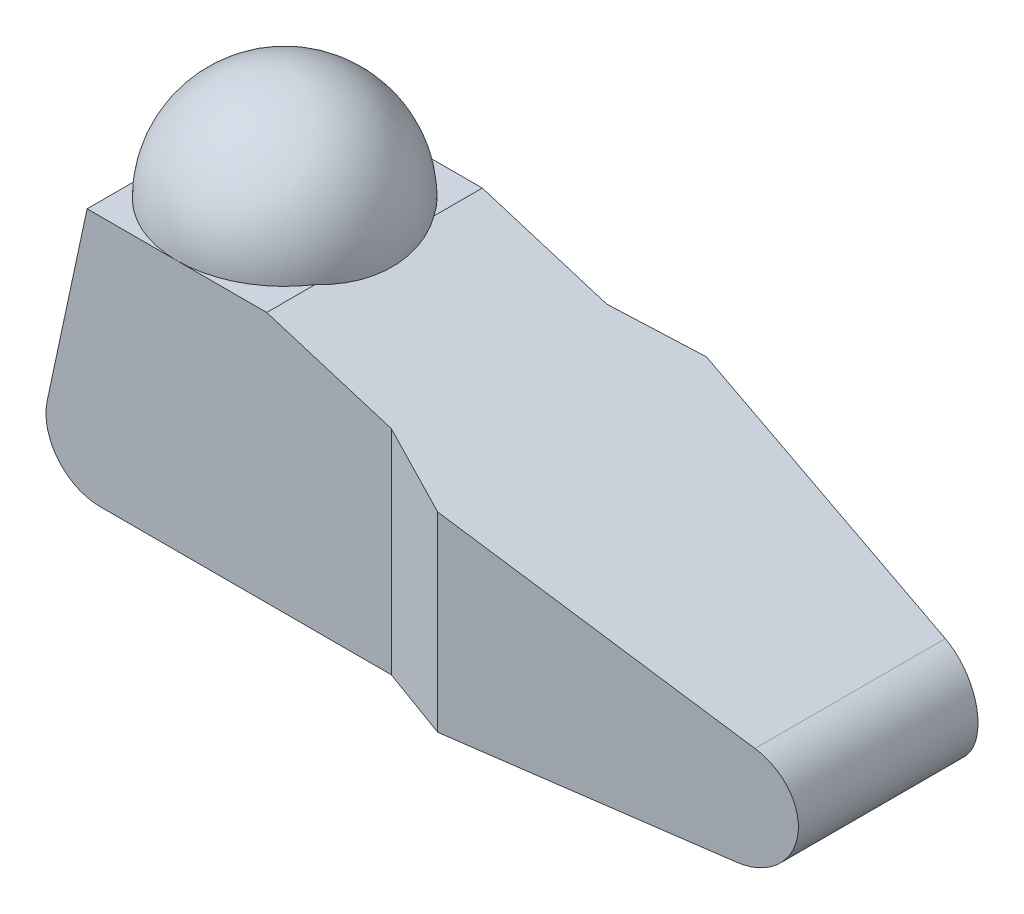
SolidWorks part; units mm, degrees
ref_plane "Front Plane" through (0, 0, 0) normal (0, 0, 1) x (1, 0, 0)
ref_plane "Top Plane" through (0, 0, 0) normal (0, 1, 0) x (1, 0, 0)
ref_plane "Right Plane" through (0, 0, 0) normal (1, 0, 0) x (0, 0, -1)
sketch "Sketch1" plane through (0, 0, 0) normal (0, 0, 1) x (1, 0, 0)
  line L0 (-27.2354, 0) -> (194.31, 0)
  line L1 (31.75, 88.9) -> (199.9025, 37.2606)
  line L2 (-31.75, 88.9) -> (31.75, 88.9)
  line L3 (-31.75, 88.9) -> (-45.8625, 23.0415)
  line L5 (0, 88.9) -> (0, 0) construction
  arc A0 (-27.2354, 0) -> (-45.8625, 23.0415) centre (-27.2354, 19.05) cw
  arc A1 (194.31, 0) -> (199.9025, 37.2606) centre (194.31, 19.05) ccw
  point P10 (-50.8, 0)
  dimension "D4" = 50.8
  dimension "D5" = 19.05
  dimension "D6" = 19.05
  dimension "D1" = 19.05
  dimension "D2" = 264.16
  dimension "D3" = 88.9
extrude "Extrude1" add sketch "Sketch1" along normal mid plane 94.996
sketch "Sketch2" plane through (0, 88.9, 0) normal (0, 1, 0) x (1, 0, 0)
  line L0 (0, -38.1) -> (0, 38.1)
  arc A0 (0, 38.1) -> (0, -38.1) centre (0, 0) ccw
  dimension "D1" = 76.2
sketch "Sketch3" plane through (0, 0, 0) normal (0, -1, 0) x (1, 0, 0)
  line L0 (213.36, 31.75) -> (101.6, 47.498)
  line L1 (-27.2354, 47.498) -> (194.31, 47.498) construction
  line L2 (101.6, 47.498) -> (75.7792, 38.1)
  line L3 (75.7792, 38.1) -> (-50.8, 38.1)
  line L4 (-50.8, 38.1) -> (-50.8, -38.1)
  line L5 (213.36, 31.75) -> (213.36, -31.75)
  line L6 (213.36, -31.75) -> (101.6, -47.498)
  line L7 (-27.2354, -47.498) -> (194.31, -47.498) construction
  line L8 (101.6, -47.498) -> (75.7792, -38.1)
  line L9 (75.7792, -38.1) -> (-50.8, -38.1)
  line L11 (0, 0) -> (-50.8, 0) construction
  line L12 (0, 0) -> (213.36, 0) construction
  line L13 (213.36, -47.498) -> (213.36, 47.498) construction
  line L14 (-50.8, 47.498) -> (-50.8, -47.498) construction
  dimension "D1" = 76.2
  dimension "D2" = 63.5
  dimension "D3" = 20
  dimension "D4" = 101.6
extrude "Cut-Extrude1" cut sketch "Sketch3" against normal blind 127 flip side to cut
revolve "Revolve1" add sketch "Sketch2" angle 360 about L0
fillet "Fillet2" [suppressed] radius 12.7
fillet "Fillet3" [suppressed] radius 25.4
